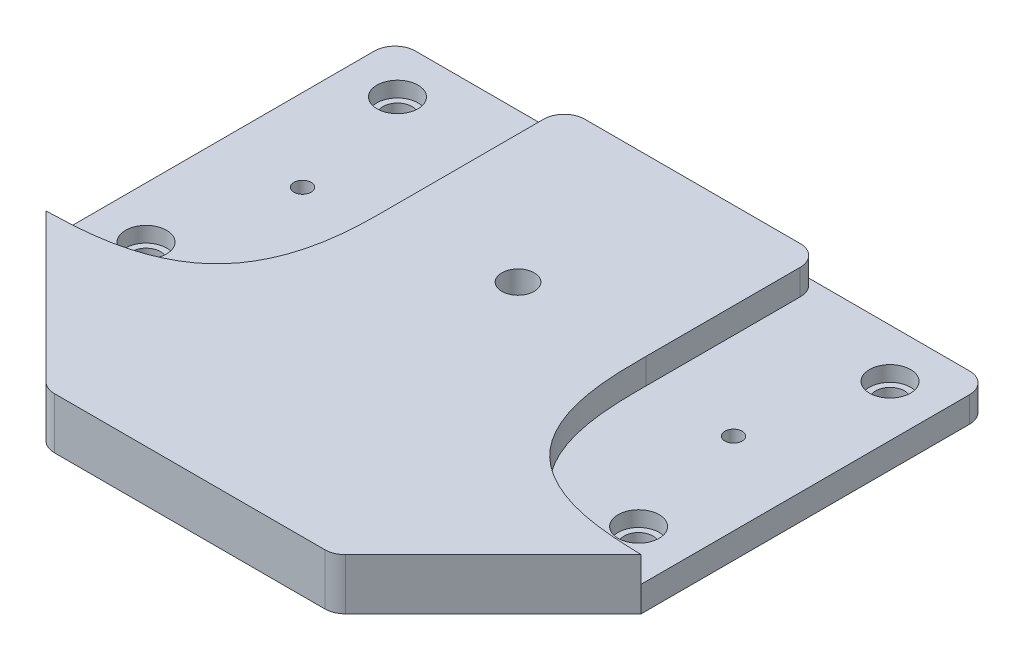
SolidWorks part; units mm, degrees
ref_plane "Front Plane" through (0, 0, 0) normal (0, 0, 1) x (1, 0, 0)
ref_plane "Top Plane" through (0, 0, 0) normal (0, 1, 0) x (1, 0, 0)
ref_plane "Right Plane" through (0, 0, 0) normal (1, 0, 0) x (0, 0, -1)
sketch "Sketch2" plane through (0, 0, 0) normal (0, 1, 0) x (1, 0, 0)
  line L2 (0, 33.02) -> (0, 0)
  line L3 (0, 0) -> (22.86, 0) construction
  line L4 (22.86, 0) -> (55.901, 38.5867) construction
  line L5 (55.901, 38.5867) -> (106.701, 38.5867) construction
  line L6 (106.701, 38.5867) -> (106.701, 56.3667)
  line L7 (0, 86.36) -> (0, 53.34)
  line L9 (0, 86.36) -> (20.32, 86.36)
  line L10 (20.32, 86.36) -> (106.701, 56.3667) construction
  line L11 (0, 53.34) -> (0, 33.02)
  line L12 (22.86, 0) -> (147.32, 0) construction
  line L13 (147.32, 0) -> (147.32, 86.36)
  line L14 (147.32, 86.36) -> (20.32, 86.36)
  line L15 (134.62, 74.295) -> (134.62, 12.065) construction
  line L16 (12.7, 74.295) -> (134.62, 74.295) construction
  line L17 (12.7, 74.295) -> (12.7, 12.065) construction
  line L18 (12.7, 12.065) -> (134.62, 12.065) construction
  line L19 (0, 0) -> (38.1, -38.1)
  line L20 (38.1, -38.1) -> (109.22, -38.1)
  line L21 (109.22, -38.1) -> (147.32, 0)
  line L22 (12.7, 74.295) -> (0, 74.295) construction
  line L23 (134.62, 74.295) -> (147.32, 74.295) construction
  line L24 (12.7, 12.065) -> (12.7, 0) construction
  line L25 (12.7, 74.295) -> (12.7, 86.36) construction
  circle A2 centre (12.7, 12.065) radius 3.556
  circle A3 centre (12.7, 74.295) radius 3.556
  circle A4 centre (73.681, 48.7467) radius 2.54 construction
  circle A5 centre (134.62, 74.295) radius 3.556
  circle A6 centre (134.62, 12.065) radius 3.556
  dimension "D10" = 7.112
  dimension "D11" = 121.92
  dimension "D19" = 7.112
  dimension "D20" = 7.112
  dimension "D22" = 5.08
  dimension "D9" = 7.112
  dimension "D1" = 50.8
  dimension "D2" = 50.8
  dimension "D3" = 22.86
  dimension "D4" = 33.02
  dimension "D5" = 20.32
  dimension "D6" = 20.32
  dimension "D7" = 91.44
  dimension "D8" = 17.78
  dimension "D12" = 62.23
  dimension "D13" = 45
  dimension "D14" = 38.1
  dimension "D21" = 10.16
  dimension "D23" = 33.02
  dimension "D24" = 147.32
extrude "Boss-Extrude1" add sketch "Sketch2" along normal blind 6.35 contours L13 L14 L9 L7 L11 L2 L3 L12 A6 A5 A3 A2
sketch "Sketch3" plane through (0, 6.35, 0) normal (0, 1, 0) x (1, 0, 0)
  line L0 (12.7, 74.295) -> (12.7, 12.065) construction
  line L1 (134.62, 43.18) -> (12.7, 43.18) construction
  line L2 (134.62, 12.065) -> (134.62, 74.295) construction
  line L3 (0, 86.36) -> (0, 0) construction
  line L4 (147.32, 0) -> (147.32, 86.36) construction
  circle A0 centre (20.32, 43.18) radius 2.1273
  circle A1 centre (127, 43.18) radius 2.1273
  dimension "D1" = 4.2545
  dimension "D2" = 4.2545
  dimension "D3" = 20.32
  dimension "D4" = 20.32
extrude "Cut-Extrude1" cut sketch "Sketch3" against normal through all
sketch "Sketch4" plane through (0, 6.35, 0) normal (0, 1, 0) x (1, 0, 0)
  line L0 (20.32, 43.18) -> (127, 43.18) construction
  circle A0 centre (73.66, 43.18) radius 4.0005
  dimension "D1" = 8.001
extrude "Cut-Extrude2" cut sketch "Sketch4" against normal through all
sketch "Sketch5" plane through (0, 6.35, 0) normal (0, 1, 0) x (1, 0, 0)
  line L0 (147.32, 86.36) -> (0, 86.36) construction
  line L2 (41.91, 0) -> (41.91, 86.36)
  line L3 (41.91, 86.36) -> (105.41, 86.36)
  line L4 (105.41, 0) -> (105.41, 86.36)
  line L5 (41.91, 0) -> (105.41, 86.36) construction
  line L6 (41.91, 86.36) -> (105.41, 0) construction
  line L7 (0, 0) -> (41.91, 0)
  line L8 (105.41, 0) -> (147.32, 0)
  line L9 (147.32, 0) -> (109.22, -38.1)
  line L10 (109.22, -38.1) -> (38.1, -38.1)
  line L11 (38.1, -38.1) -> (0, 0)
  circle A0 centre (73.66, 43.18) radius 4.0005
  circle A1 centre (73.66, 43.18) radius 4.0005 construction
  point P0 (73.66, 43.18)
  dimension "D1" = 63.5
extrude "Boss-Extrude2" add sketch "Sketch5" along normal blind 6.35
fillet "Fillet1" radius 43.18 2 edges at (105.41, 9.525, 0) (41.91, 9.525, 0)
fillet "Fillet3" radius 5.08 6 edges at (0, 3.175, -86.36) (41.91, 9.525, -86.36) (105.41, 9.525, -86.36) (147.32, 3.175, -86.36) (109.22, 6.35, 38.1) (38.1, 6.35, 38.1)
sketch "Sketch6" plane through (0, 6.35, 0) normal (0, 1, 0) x (1, 0, 0)
  circle A0 centre (12.7, 74.295) radius 5.08
  circle A1 centre (12.7, 12.065) radius 5.08
  circle A2 centre (134.62, 74.295) radius 5.08
  circle A3 centre (134.62, 12.065) radius 5.08
  dimension "D1" = 10.16
  dimension "D2" = 10.16
  dimension "D3" = 10.16
  dimension "D4" = 10.16
extrude "Cut-Extrude3" cut sketch "Sketch6" against normal blind 3.81
sketch "Sketch7" plane through (0, 0, 0) normal (0, -1, 0) x (1, 0, 0)
  circle A0 centre (73.66, -43.18) radius 22.225
  dimension "D1" = 44.45
extrude "Cut-Extrude4" cut sketch "Sketch7" against normal blind 5.08
fillet "Fillet4" radius 5.08 1 edges at (73.66, 5.08, -65.405)
